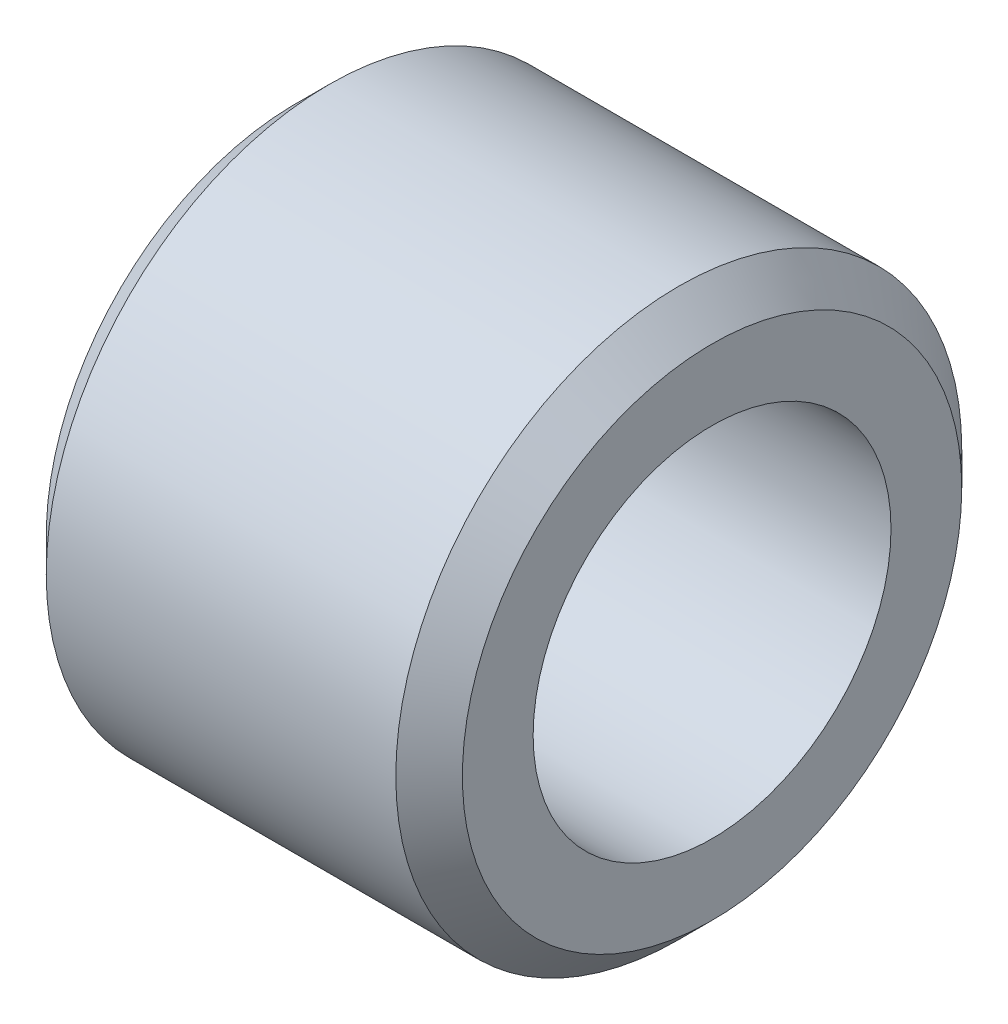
SolidWorks part; units mm, degrees
ref_plane "Front Plane" through (0, 0, 0) normal (0, 0, 1) x (1, 0, 0)
ref_plane "Top Plane" through (0, 0, 0) normal (0, 1, 0) x (1, 0, 0)
ref_plane "Right Plane" through (0, 0, 0) normal (1, 0, 0) x (0, 0, -1)
sketch "Sketch1" plane through (0, 0, 0) normal (0, 1, 0) x (1, 0, 0)
  line L1 (0, 0) -> (6.35, 0)
  line L2 (0, 0) -> (0, 1.5875)
  line L3 (0, 1.5875) -> (6.35, 1.5875)
  line L4 (6.35, 0) -> (6.35, 1.5875)
  dimension "D1" = 6.35
  dimension "D2" = 1.5875
sketch "Sketch2" plane through (0, 0, 0) normal (1, 0, 0) x (0, 0, -1)
  circle A0 centre (-2.7305, 0) radius 2.7305
  dimension "D1" = 5.461
sweep "Sweep1" add profiles "Sketch1" path "Sketch2"
chamfer "Chamfer1" distance 0.508 angle 45 2 edges at (6.35, 0, -1.5875) (0, 0, -1.5875)
